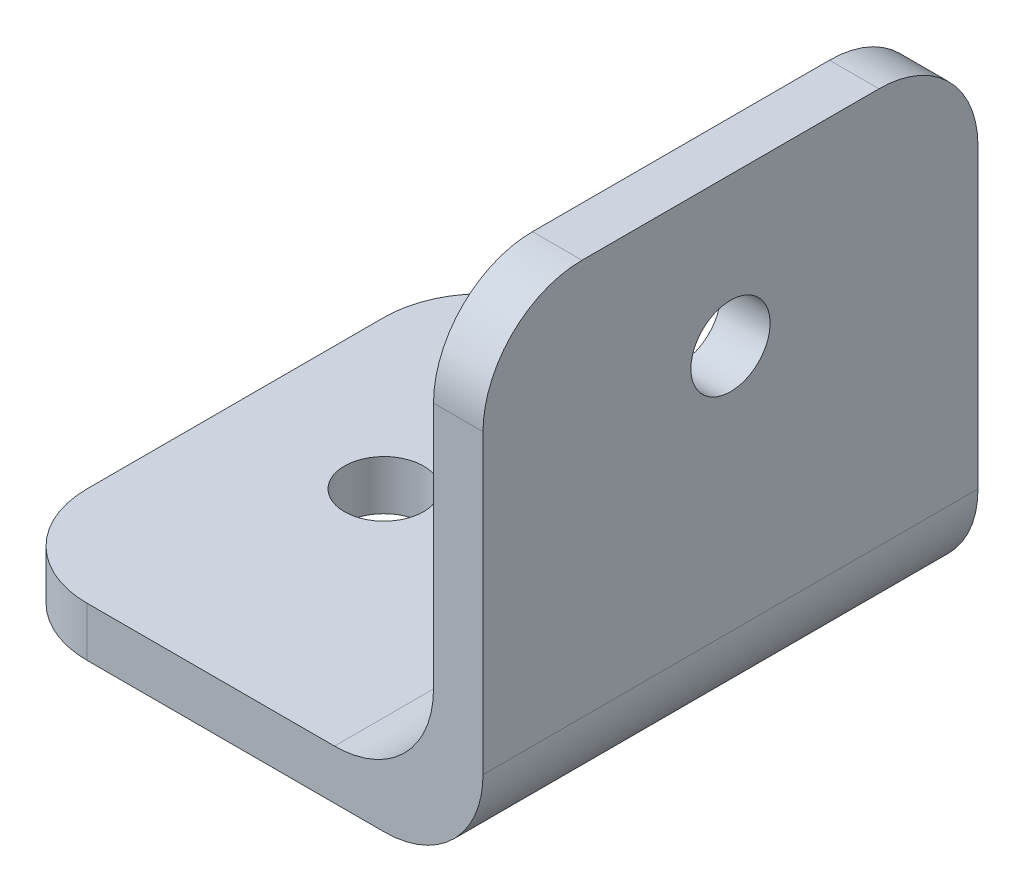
SolidWorks part; units mm, degrees
ref_plane "Front Plane" through (0, 0, 0) normal (0, 0, 1) x (1, 0, 0)
ref_plane "Top Plane" through (0, 0, 0) normal (0, 1, 0) x (1, 0, 0)
ref_plane "Right Plane" through (0, 0, 0) normal (1, 0, 0) x (0, 0, -1)
sketch "Sketch1" plane through (0, 0, 0) normal (0, 0, 1) x (1, 0, 0)
  line L1 (0, 0) -> (50, 0)
  line L2 (0, 0) -> (0, 5)
  line L3 (0, 5) -> (45, 5)
  line L4 (50, 0) -> (50, 50)
  line L7 (50, 50) -> (45, 50)
  line L8 (45, 5) -> (45, 50)
  dimension "D1" = 50
  dimension "D2" = 50
  dimension "D3" = 45
  dimension "D4" = 45
extrude "Boss-Extrude1" add sketch "Sketch1" along normal blind 50
fillet "Fillet1" radius 10 6 edges at (0, 2.5, 0) (0, 2.5, 50) (47.5, 50, 0) (47.5, 50, 50) (50, 0, 25) (45, 5, 25)
sketch "Sketch2" plane through (45, 0, 0) normal (-1, 0, 0) x (0, 0, 1)
  line L0 (25, 50) -> (25, 27.566) construction
  line L1 (40, 50) -> (10, 50) construction
  circle A0 centre (25, 35) radius 4
  dimension "D1" = 8
  dimension "D2" = 15
extrude "Cut-Extrude1" cut sketch "Sketch2" against normal blind 50
sketch "Sketch3" plane through (0, 5, 0) normal (0, 1, 0) x (1, 0, 0)
  line L0 (0, -25) -> (23.7375, -25) construction
  line L1 (0, -40) -> (0, -10) construction
  circle A0 centre (15, -25) radius 4
  dimension "D1" = 8
  dimension "D2" = 15
extrude "Cut-Extrude2" cut sketch "Sketch3" against normal blind 50
